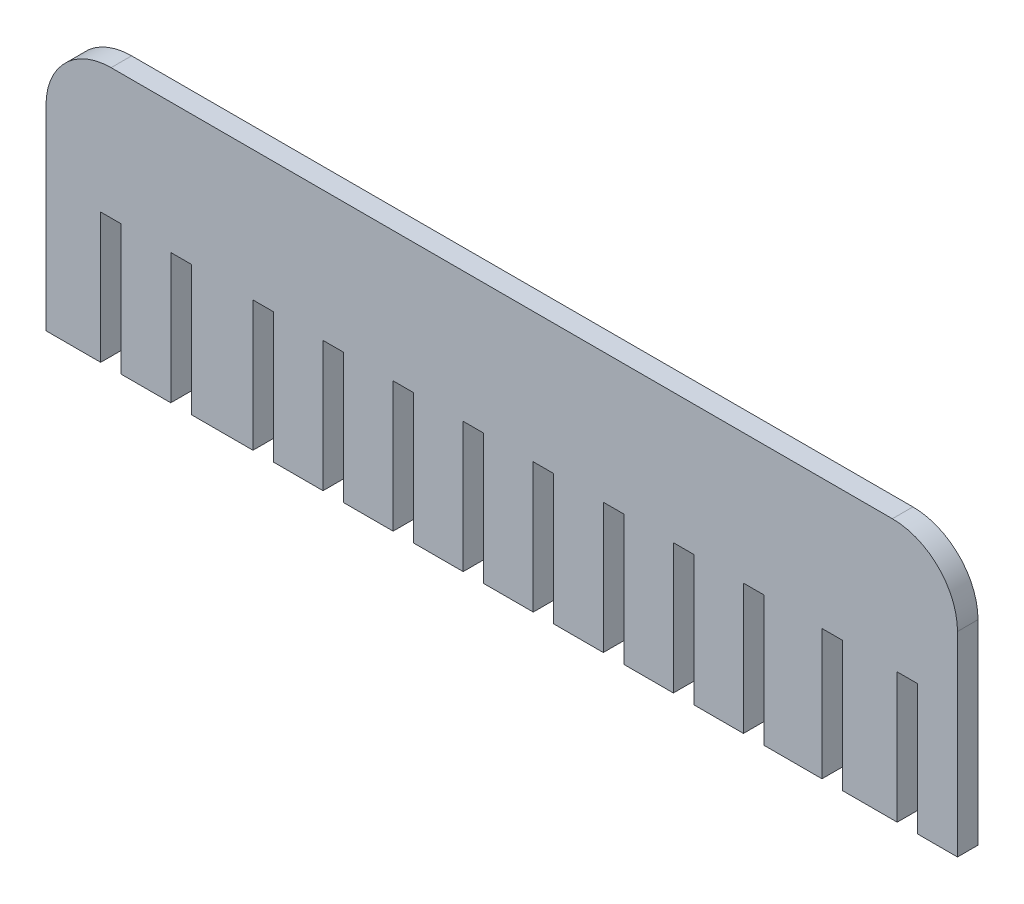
SolidWorks part; units mm, degrees
ref_plane "Front Plane" through (0, 0, 0) normal (0, 0, 1) x (1, 0, 0)
ref_plane "Top Plane" through (0, 0, 0) normal (0, 1, 0) x (1, 0, 0)
ref_plane "Right Plane" through (0, 0, 0) normal (1, 0, 0) x (0, 0, -1)
sketch "Sketch1" plane through (0, 0, 0) normal (0, 0, 1) x (1, 0, 0)
  line L0 (-60.564, -88.9) -> (-49.8, -88.9)
  line L1 (-74.232, -88.9) -> (-64.564, -88.9)
  line L2 (-78.232, -88.9) -> (-78.232, 38.1)
  line L3 (-78.232, 38.1) -> (-74.232, 38.1)
  line L4 (-74.232, -88.9) -> (-74.232, 38.1)
  line L5 (-88.9, 88.9) -> (88.9, -88.9) construction
  line L6 (-88.9, -88.9) -> (88.9, 88.9) construction
  line L7 (-49.8, -88.9) -> (-49.8, 38.1)
  line L8 (-49.8, 38.1) -> (-48.53, 38.1)
  line L9 (51.8, 38.1) -> (51.8, -88.9)
  line L10 (-88.9, -88.9) -> (-78.232, -88.9)
  line L11 (51.8, -88.9) -> (62.468, -88.9)
  line L12 (-88.9, -88.9) -> (-88.9, 88.9)
  line L13 (-88.9, 88.9) -> (88.9, 88.9)
  line L14 (88.9, -88.9) -> (88.9, 88.9)
  line L15 (-64.564, -88.9) -> (-64.564, 38.1)
  line L16 (-64.564, 38.1) -> (-60.564, 38.1)
  line L17 (-60.564, -88.9) -> (-60.564, 38.1)
  line L18 (81.136, -88.9) -> (88.9, -88.9)
  line L19 (66.468, -88.9) -> (77.136, -88.9)
  line L20 (-44.53, 38.1) -> (-34.862, 38.1)
  line L22 (-30.862, 38.1) -> (-21.194, 38.1)
  line L23 (62.468, -88.9) -> (62.468, 38.1)
  line L24 (62.468, 38.1) -> (66.468, 38.1)
  line L25 (66.468, -88.9) -> (66.468, 38.1)
  line L26 (-17.194, 38.1) -> (-7.526, 38.1)
  line L27 (77.136, -88.9) -> (77.136, 38.1)
  line L28 (77.136, 38.1) -> (81.136, 38.1)
  line L29 (81.136, -88.9) -> (81.136, 38.1)
  line L30 (-48.53, 38.1) -> (-48.53, 63.5)
  line L31 (-48.53, 63.5) -> (-44.53, 63.5)
  line L32 (-44.53, 38.1) -> (-44.53, 63.5)
  line L33 (-3.526, 38.1) -> (6.142, 38.1)
  line L34 (-34.862, 38.1) -> (-34.862, 63.5)
  line L35 (-34.862, 63.5) -> (-30.862, 63.5)
  line L36 (-30.862, 38.1) -> (-30.862, 63.5)
  line L37 (10.142, 38.1) -> (19.81, 38.1)
  line L38 (-21.194, 38.1) -> (-21.194, 63.5)
  line L39 (-21.194, 63.5) -> (-17.194, 63.5)
  line L40 (-17.194, 38.1) -> (-17.194, 63.5)
  line L41 (23.81, 38.1) -> (33.478, 38.1)
  line L42 (-7.526, 38.1) -> (-7.526, 63.5)
  line L43 (-7.526, 63.5) -> (-3.526, 63.5)
  line L44 (-3.526, 38.1) -> (-3.526, 63.5)
  line L45 (37.478, 38.1) -> (47.146, 38.1)
  line L46 (6.142, 38.1) -> (6.142, 63.5)
  line L47 (6.142, 63.5) -> (10.142, 63.5)
  line L48 (10.142, 38.1) -> (10.142, 63.5)
  line L49 (51.146, 38.1) -> (51.8, 38.1)
  line L50 (19.81, 38.1) -> (19.81, 63.5)
  line L51 (19.81, 63.5) -> (23.81, 63.5)
  line L52 (23.81, 38.1) -> (23.81, 63.5)
  line L54 (33.478, 38.1) -> (33.478, 63.5)
  line L55 (33.478, 63.5) -> (37.478, 63.5)
  line L56 (37.478, 38.1) -> (37.478, 63.5)
  line L58 (47.146, 38.1) -> (47.146, 63.5)
  line L59 (47.146, 63.5) -> (51.146, 63.5)
  line L60 (51.146, 38.1) -> (51.146, 63.5)
  point P0 (0, 0)
  point P12 (-78.232, -88.9)
  point P13 (-61.564, -88.9)
  point P14 (-75.232, -88.9)
  point P16 (-64.564, -88.9)
extrude "Boss-Extrude1" add sketch "Sketch1" along normal blind 4
fillet "Fillet1" radius 12.7 1 edges at (88.9, 88.9, 2)
fillet "Fillet2" radius 12.7 1 edges at (-88.9, 88.9, 2)
sketch "Sketch2" plane through (0, 0, 4) normal (0, 0, 1) x (1, 0, 0)
  line L0 (51.146, 38.1) -> (88.9, 38.1)
  line L1 (88.9, -88.9) -> (88.9, 76.2) construction
  line L3 (62.468, 38.1) -> (66.468, 38.1)
  line L4 (62.468, 38.1) -> (62.468, 63.5)
  line L5 (62.468, 63.5) -> (66.468, 63.5)
  line L6 (66.468, 38.1) -> (66.468, 63.5)
  line L7 (77.136, 38.1) -> (81.136, 38.1)
  line L8 (77.136, 38.1) -> (77.136, 63.5)
  line L9 (77.136, 63.5) -> (81.136, 63.5)
  line L10 (81.136, 38.1) -> (81.136, 63.5)
extrude "Cut-Extrude3" cut sketch "Sketch2" against normal blind 3.048 contours L0 L10 L9 L8 | L0 L6 L5 L4
sketch "Sketch5" plane through (0, 0, 4) normal (0, 0, 1) x (1, 0, 0)
  line L1 (-78.232, 38.1) -> (-74.232, 38.1)
  line L2 (-78.232, 38.1) -> (-78.232, 63.5)
  line L3 (-78.232, 63.5) -> (-74.232, 63.5)
  line L4 (-74.232, 38.1) -> (-74.232, 63.5)
  line L5 (-64.564, 38.1) -> (-60.564, 38.1)
  line L6 (-64.564, 38.1) -> (-64.564, 63.5)
  line L7 (-64.564, 63.5) -> (-60.564, 63.5)
  line L8 (-60.564, 38.1) -> (-60.564, 63.5)
extrude "Cut-Extrude4" cut sketch "Sketch5" against normal blind 4
sketch "Sketch6" plane through (0, 0, 4) normal (0, 0, 1) x (1, 0, 0)
  line L0 (88.9, -88.9) -> (88.9, 76.2) construction
  line L1 (-88.9, -88.9) -> (88.9, -88.9)
  line L2 (-88.9, -88.9) -> (-88.9, 38.1)
  line L3 (-88.9, 38.1) -> (88.9, 38.1)
  line L4 (88.9, -88.9) -> (88.9, 38.1)
extrude "Cut-Extrude5" cut sketch "Sketch6" against normal blind 4
sketch "Sketch7" plane through (0, 0, 0.952) normal (0, 0, 1) x (1, 0, 0)
  line L1 (62.468, 38.1) -> (66.468, 38.1)
  line L2 (62.468, 38.1) -> (62.468, 63.5)
  line L3 (62.468, 63.5) -> (66.468, 63.5)
  line L4 (66.468, 38.1) -> (66.468, 63.5)
extrude "Cut-Extrude6" cut sketch "Sketch7" against normal blind 4
sketch "Sketch8" plane through (0, 0, 0.952) normal (0, 0, 1) x (1, 0, 0)
  line L1 (77.136, 38.1) -> (81.136, 38.1)
  line L2 (77.136, 38.1) -> (77.136, 63.5)
  line L3 (77.136, 63.5) -> (81.136, 63.5)
  line L4 (81.136, 38.1) -> (81.136, 63.5)
extrude "Cut-Extrude7" cut sketch "Sketch8" against normal blind 4
equation "\"major-height\"= 7in"
equation "\"major-teeth-height\"= 5in"
equation "\"minor-height\"= 2in"
equation "\"minor-teeth height\"= 1in"
equation "\"distance-between-teeth\"= 0.42"
equation "\"sheet-thickness\" = 4mm"
equation "\"D1@Sketch1\"=\"major-height\""
equation "\"width\"= 7in"
equation "\"D2@Sketch1\"=\"width\""
equation "\"D3@Sketch1\"=\"major-teeth-height\""
equation "\"D4@Sketch1\"=\"sheet-thickness\""
equation "\"D5@Sketch1\"=\"major-teeth-height\""
equation "\"D6@Sketch1\"=\"sheet-thickness\""
equation "\"D9@Sketch1\"=\"sheet-thickness\""
equation "\"D10@Sketch1\"=\"major-teeth-height\""
equation "\"D11@Sketch1\"=\"sheet-thickness\""
equation "\"D12@Sketch1\"=\"major-teeth-height\""
equation "\"D8@Sketch1\"=\"sheet-thickness\""
equation "\"D13@Sketch1\"=\"minor-teeth height\""
equation "\"D14@Sketch1\"=\"sheet-thickness\""
equation "\"D15@Sketch1\"=\"minor-teeth height\""
equation "\"D16@Sketch1\"=\"sheet-thickness\""
equation "\"D17@Sketch1\"=\"minor-teeth height\""
equation "\"D18@Sketch1\"=\"sheet-thickness\""
equation "\"D19@Sketch1\"=\"minor-teeth height\""
equation "\"D20@Sketch1\"=\"sheet-thickness\""
equation "\"D21@Sketch1\"=\"minor-teeth height\""
equation "\"D22@Sketch1\"=\"sheet-thickness\""
equation "\"D23@Sketch1\"=\"minor-teeth height\""
equation "\"D24@Sketch1\"=\"sheet-thickness\""
equation "\"D25@Sketch1\"=\"minor-teeth height\""
equation "\"D26@Sketch1\"=\"sheet-thickness\""
equation "\"D27@Sketch1\"=\"minor-teeth height\""
equation "\"D1@Boss-Extrude1\"=\"sheet-thickness\""
equation "\"edges\"= 0.5in"
equation "\"D1@Fillet1\"=\"edges\""
equation "\"D1@Fillet2\"=\"edges\""
equation "\"D1@Sketch2\"=\"sheet-thickness\""
equation "\"D2@Sketch2\"=\"minor-teeth height\""
equation "\"D3@Sketch2\"=\"sheet-thickness\""
equation "\"D4@Sketch2\"=\"minor-teeth height\""
equation "\"D1@Sketch5\"=\"sheet-thickness\""
equation "\"D2@Sketch5\"=\"minor-teeth height\""
equation "\"D3@Sketch5\"=\"sheet-thickness\""
equation "\"D4@Sketch5\"=\"minor-teeth height\""
equation "\"D1@Cut-Extrude4\"=\"sheet-thickness\""
equation "\"D1@Cut-Extrude5\"=\"sheet-thickness\""
equation "\"D1@Cut-Extrude6\"=\"sheet-thickness\""
equation "\"D1@Cut-Extrude7\"=\"sheet-thickness\""
